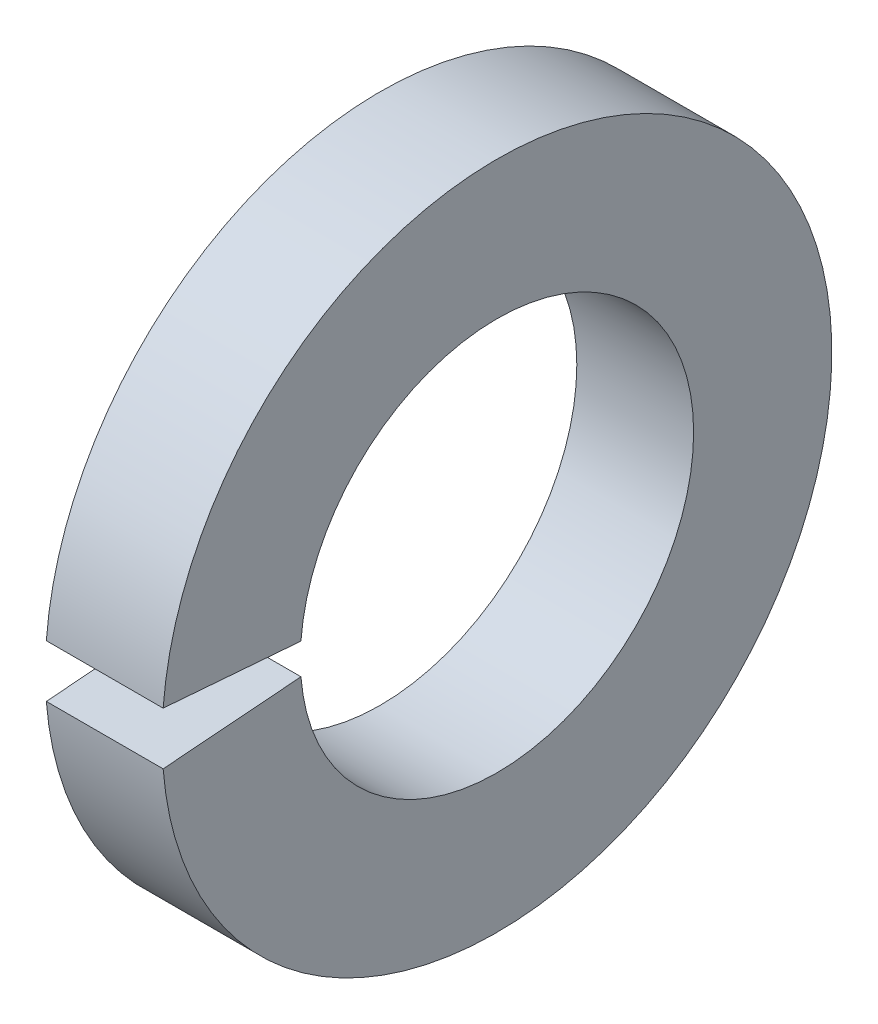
SolidWorks part; units mm, degrees
ref_plane "Plane1" through (0, 0, 0) normal (0, 0, 1) x (1, 0, 0)
ref_plane "Plane2" through (0, 0, 0) normal (0, 1, 0) x (1, 0, 0)
ref_plane "Plane3" through (0, 0, 0) normal (1, 0, 0) x (0, 0, -1)
sketch "Sketch1" plane through (0, 0, 0) normal (0, 0, 1) x (1, 0, 0)
  line L0 (-34.925, 0) -> (9.525, 0) construction
  line L1 (0, 10.1) -> (0, 17.2)
  line L2 (0, 17.2) -> (-6, 17.2)
  line L3 (-6, 17.2) -> (-6, 10.1)
  line L4 (-6, 10.1) -> (0, 10.1)
  dimension "Thickness" = 6
  dimension "Inside_dia" = 20.2
  dimension "Outside_dia" = 34.4
revolve "Base-Revolve" add sketch "Sketch1" angle 360 about L0
sketch "Sketch2" plane through (0, 0, 0) normal (-1, 0, 0) x (0, -1, 0)
  line L0 (0, 0) -> (1.3765, 17.4899)
  line L1 (0, -3.175) -> (0, 12.7) construction
  line L2 (0, 0) -> (-1.3765, 17.4899)
  arc A0 (1.3765, 17.4899) -> (-1.3765, 17.4899) centre (0, 0) ccw
  dimension "D1" = 17.544
  dimension "Gap_ang" = 9
extrude "Gap" cut sketch "Sketch2" along normal through all
equation "\"D1@Sketch2\" = \"Outside_dia@Sketch1\" * 0.51"
